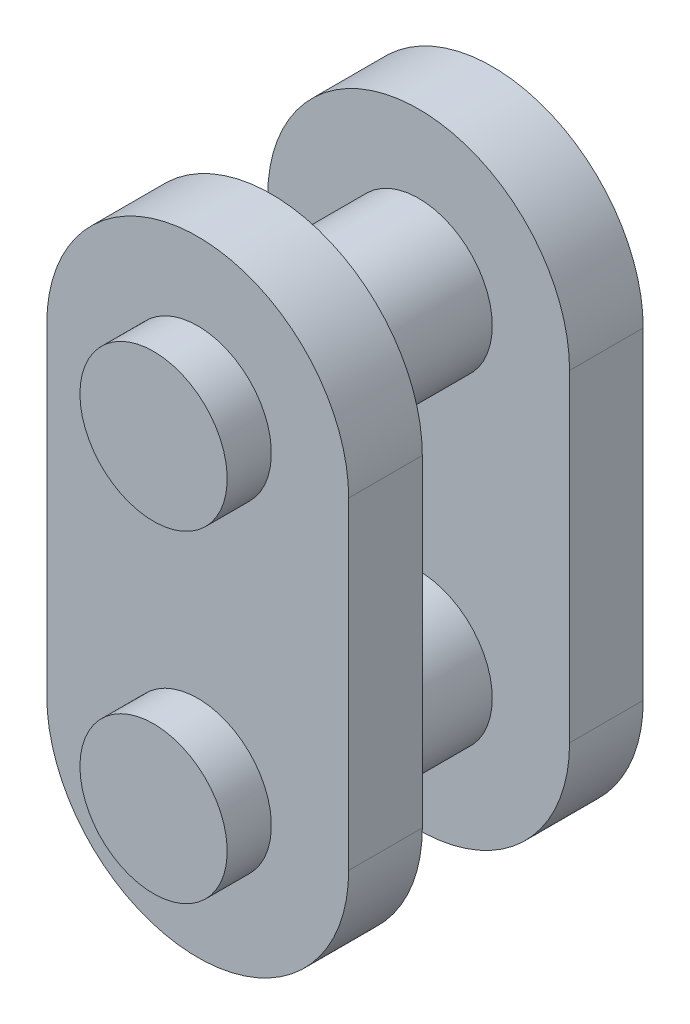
SolidWorks part; units mm, degrees
ref_plane "Ebene1" through (0, 0, 0) normal (0, 0, 1) x (1, 0, 0)
ref_plane "Ebene2" through (0, 0, 0) normal (0, 1, 0) x (1, 0, 0)
ref_plane "Ebene3" through (0, 0, 0) normal (1, 0, 0) x (0, 0, -1)
sketch "Skizze1" plane through (0, 0, 0) normal (0, 0, 1) x (1, 0, 0)
  line L0 (-5.125, 5.475) -> (-5.125, -5.475)
  line L1 (0, 10.6) -> (0, -10.6) construction
  line L2 (5.125, 5.475) -> (5.125, -5.475)
  arc A0 (-5.125, 5.475) -> (5.125, 5.475) centre (0, 5.475) cw
  arc A1 (-5.125, -5.475) -> (5.125, -5.475) centre (0, -5.475) ccw
  dimension "D2" = 21.2
  dimension "D1" = 10.25
extrude "Basis-Linear austragen" add sketch "Skizze1" along normal mid plane 10
sketch "Skizze2" plane through (0, 0, 0) normal (0, 0, 1) x (1, 0, 0)
  line L2 (-5.125, 5.475) -> (-5.125, -5.475)
  line L3 (5.125, -5.475) -> (5.125, 5.475)
  line L4 (-5.125, 5.475) -> (-5.125, -5.475)
  line L5 (5.125, -5.475) -> (5.125, 5.475)
  circle A0 centre (0, 5.475) radius 2.5
  circle A1 centre (0, -5.475) radius 2.5
  arc A2 (5.125, 5.475) -> (-5.125, 5.475) centre (0, 5.475) ccw
  arc A3 (-5.125, -5.475) -> (5.125, -5.475) centre (0, -5.475) ccw
  arc A4 (5.125, 5.475) -> (-5.125, 5.475) centre (0, 5.475) ccw
  arc A5 (-5.125, -5.475) -> (5.125, -5.475) centre (0, -5.475) ccw
  dimension "D2" = 5
  dimension "D1" = 0
extrude "Schnitt-Linear austragen1" cut sketch "Skizze2" against normal mid plane 5
sketch "Skizze3" plane through (0, 0, 0) normal (0, 0, 1) x (1, 0, 0)
  circle A0 centre (0, -5.475) radius 2.5 construction
  circle A1 centre (0, 5.475) radius 2.5 construction
  circle A2 centre (0, -5.475) radius 2.5
  circle A3 centre (0, 5.475) radius 2.5
extrude "Aufsatz-Linear austragen1" add sketch "Skizze3" along normal mid plane 13
